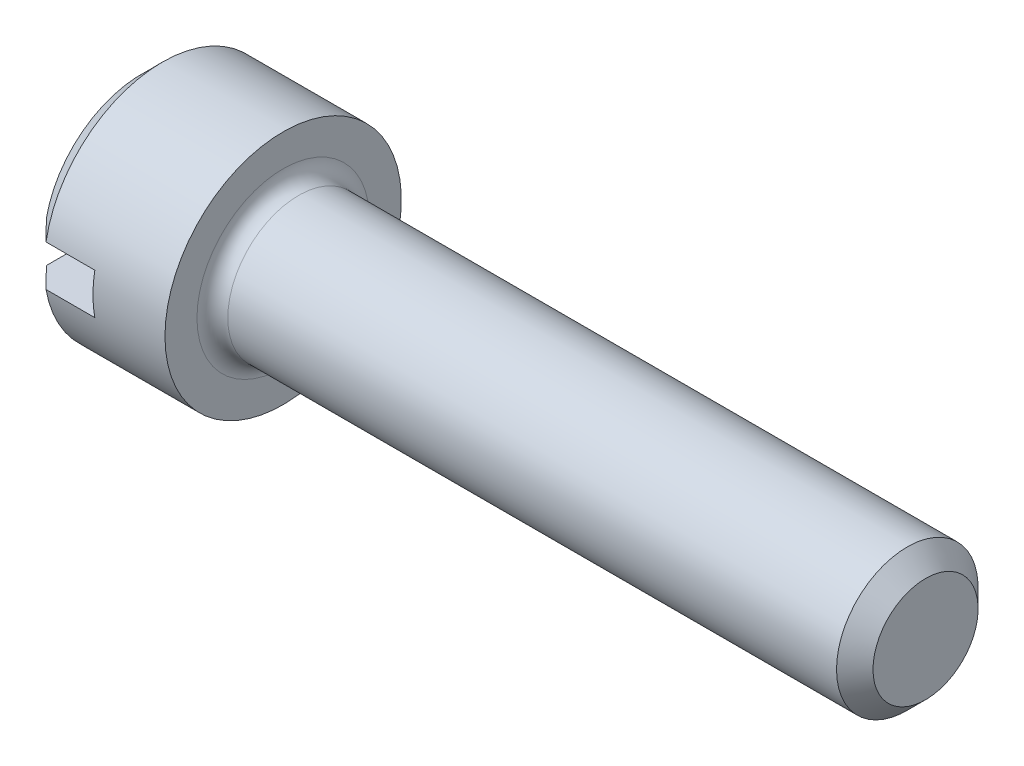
SolidWorks part; units mm, degrees
ref_plane "Plane1" through (0, 0, 0) normal (0, 0, 1) x (1, 0, 0)
ref_plane "Plane2" through (0, 0, 0) normal (0, 1, 0) x (1, 0, 0)
ref_plane "Plane3" through (0, 0, 0) normal (1, 0, 0) x (0, 0, -1)
sketch "BodySke" plane through (0, 0, 0) normal (0, 0, 1) x (1, 0, 0)
  line L0 (1.397, 0.6998) -> (1.397, 1.1684)
  line L1 (0, 0) -> (0, 0.9652)
  line L2 (-25.4, 0) -> (127, 0) construction
  line L3 (7.747, 0) -> (0, 0)
  line L4 (1.397, 0.6998) -> (7.5667, 0.6998)
  line L5 (7.747, 0.5194) -> (7.747, 0)
  line L6 (0.2032, 1.1684) -> (1.397, 1.1684)
  line L7 (0.2032, 1.1684) -> (0, 0.9652)
  line L8 (7.5667, 0.6998) -> (7.747, 0.5194)
  line L9 (1.524, -3.175) -> (1.524, 3.175) construction
  line L10 (6.35, 0) -> (6.35, 3.175) construction
  dimension "Head_ht" = 1.397
  dimension "Diameter" = 1.3995
  dimension "Length" = 6.35
  dimension "Head_dia" = 2.3368
  dimension "Minor_dia" = 1.0389
  dimension "D6" = 45
  dimension "D7" = 45
  dimension "Head_chf_len" = 0.2032
  dimension "Advance" = 0.254
  dimension "Thread_nom" = 1.397
revolve "Base-Revolve" add sketch "BodySke"
fillet "Fillet1" radius 0.1524 1 edges at (1.397, 0, 0.6998)
ref_plane "Plane4" through (0.6858, 0, 0) normal (1, 0, 0) x (0, 0, -1)
sketch "Sketch2" plane through (0.6858, 0, 0) normal (1, 0, 0) x (0, 0, -1)
  line L0 (1.1684, -0.2032) -> (-1.1684, -0.2032)
  line L1 (1.1684, -0.2032) -> (1.1684, 0.2032)
  line L2 (-1.1684, 0.2032) -> (1.1684, 0.2032)
  line L3 (-1.1684, 0.2032) -> (-1.1684, -0.2032)
  dimension "D1" = 2.3368
  dimension "D2" = 1.1684
  dimension "Slot_width" = 0.4064
  dimension "D3" = 0.2032
extrude "Slot" cut sketch "Sketch2" against normal through all
sketch "ThdSchSke" plane through (0, 0, 0) normal (0, 0, 1) x (1, 0, 0)
  line L0 (6.35, -0.5194) -> (6.2237, -0.6998)
  line L1 (6.35, -0.5194) -> (6.4763, -0.6998)
  line L2 (6.4763, -0.6998) -> (6.4763, -0.8747)
  line L3 (-3.175, 0) -> (5.1513, 0) construction
  line L4 (0, -0.2032) -> (0, -0.9652) construction
  line L5 (6.4763, -0.8747) -> (6.2237, -0.8747)
  line L6 (6.2237, -0.8747) -> (6.2237, -0.6998)
  dimension "Thread_minor" = 1.0389
  dimension "Diameter" = 1.3995
  dimension "Start" = 6.35
  dimension "SideAngle" = 55
  dimension "VeeAngle" = 70
  dimension "Overcut" = 1.7494
revolve "ThreadSchematic" [suppressed] cut sketch "ThdSchSke" angle 360 about L3
pattern_linear "ThdSchPat" [suppressed]
equation "\"D1@Sketch2\" = \"Head_dia@BodySke\""
equation "\"D2@Sketch2\" = \"D1@Sketch2\" / 2"
equation "\"D3@Sketch2\" = \"Slot_width@Sketch2\" / 2"
equation "\"Thread_minor@ThreadCosmetic\" = \"Minor_dia@BodySke\""
equation "\"Thread_length@ThreadCosmetic\" = ((sgn( (\"Length@BodySke\" - \"Advance@BodySke\" ) - \"Thread_nom@BodySke\" )-1)*( (\"Length@BodySke\" - \"Advance@BodySke\" ) - \"Thread_nom@BodySke\" ))/-2+ \"Thread_nom@BodySke\""
equation "\"Thread_minor@ThdSchSke\" = \"Minor_dia@BodySke\""
equation "\"Diameter@ThdSchSke\" = \"Diameter@BodySke\""
equation "\"Overcut@ThdSchSke\" = \"Diameter@BodySke\" * 1.25"
equation "\"Start@ThdSchSke\" = \"Head_ht@BodySke\" + \"Length@BodySke\" - \"Thread_length@ThreadCosmetic\"  '---Non-countersunk---"
equation "\"Num_threads@ThdSchPat\" = int( \"Thread_length@ThreadCosmetic\" / \"Advance@BodySke\" + 0.999 )  + 1"
equation "\"Advance@ThdSchPat\" = \"Thread_length@ThreadCosmetic\" /  (\"Num_threads@ThdSchPat\" - 1) 'relax it"
equation "\"Num_threads@ThdSchPat\" = \"Num_threads@ThdSchPat\" - sgn( \"Num_threads@ThdSchPat\" - 1) '---chamfered tips only---"
